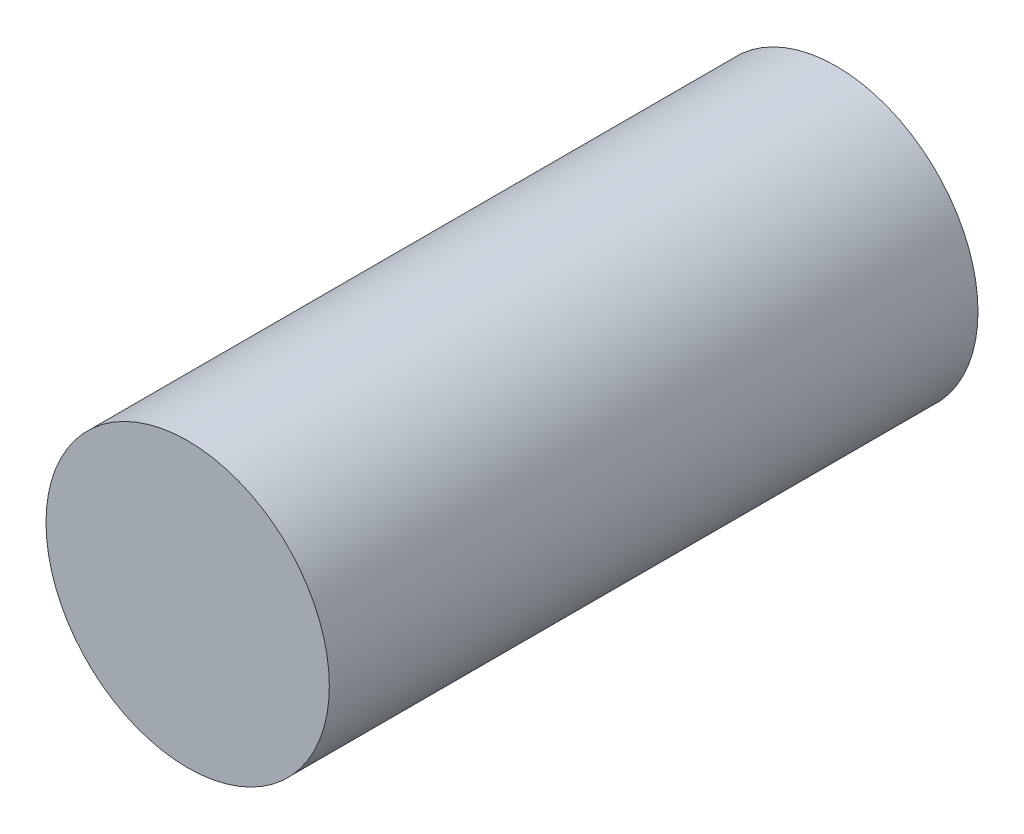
SolidWorks part; units mm, degrees
ref_plane "Front Plane" through (0, 0, 0) normal (0, 0, 1) x (1, 0, 0)
ref_plane "Top Plane" through (0, 0, 0) normal (0, 1, 0) x (1, 0, 0)
ref_plane "Right Plane" through (0, 0, 0) normal (1, 0, 0) x (0, 0, -1)
sketch "Sketch1" plane through (0, 0, 0) normal (0, 0, 1) x (1, 0, 0)
  circle A0 centre (-4, 4) radius 0.3606
extrude "Component_Outline" add sketch "Sketch1" along normal blind 1.651 separate body
